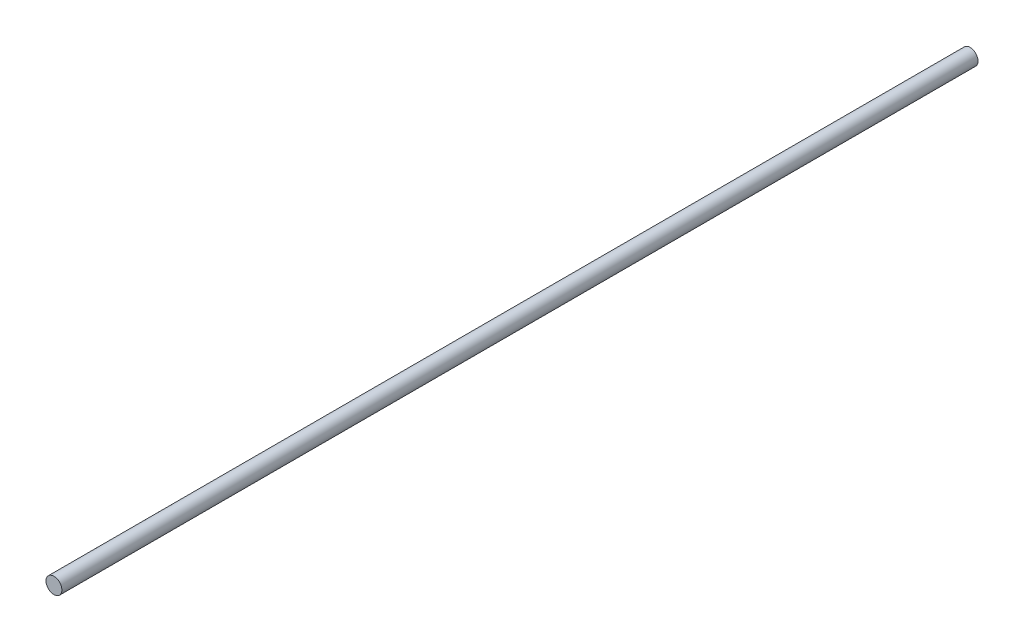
SolidWorks part; units mm, degrees
ref_plane "Front Plane" through (0, 0, 0) normal (0, 0, 1) x (1, 0, 0)
ref_plane "Top Plane" through (0, 0, 0) normal (0, 1, 0) x (1, 0, 0)
ref_plane "Right Plane" through (0, 0, 0) normal (1, 0, 0) x (0, 0, -1)
sketch "Sketch1" plane through (0, 0, 0) normal (0, 0, 1) x (1, 0, 0)
  circle A0 centre (0, 0) radius 3.9688
  dimension "D1" = 7.9375
extrude "Boss-Extrude1" add sketch "Sketch1" along normal blind 457.2
